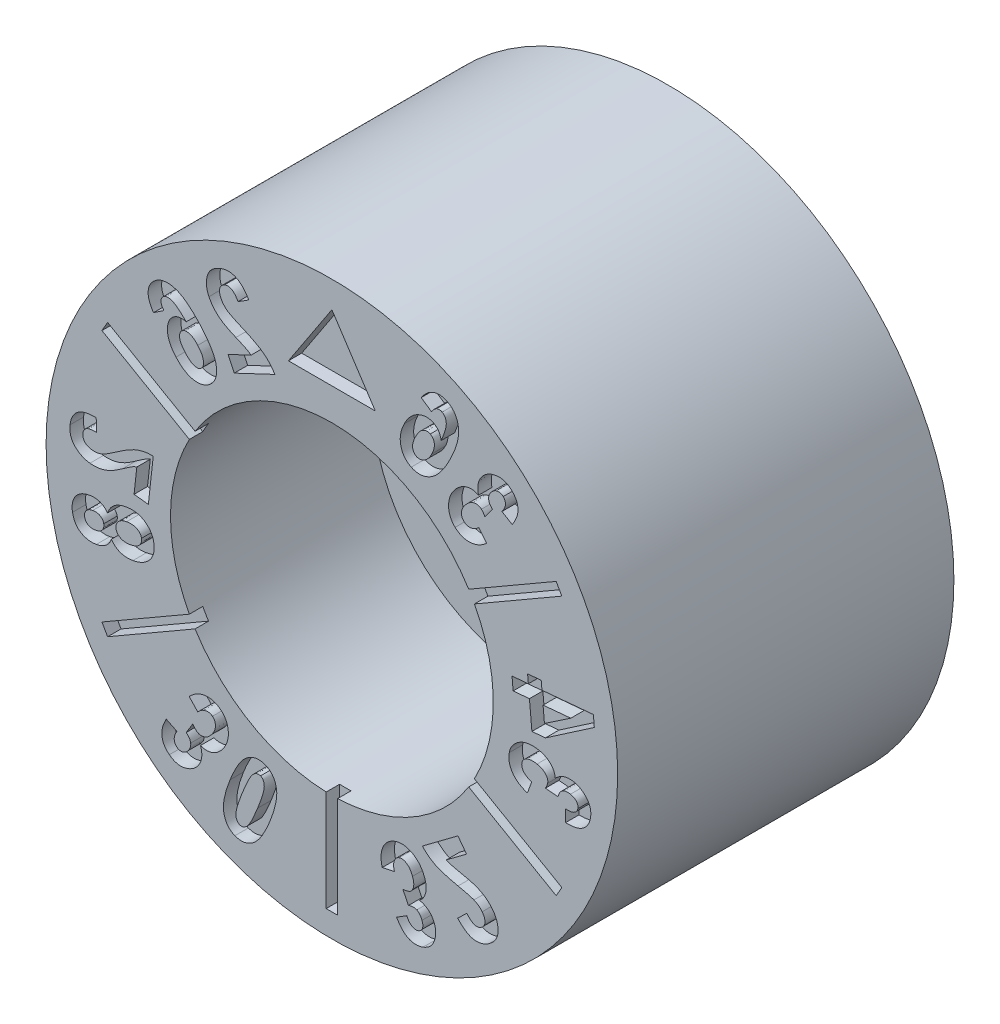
SolidWorks part; units mm, degrees
ref_plane "Front Plane" through (0, 0, 0) normal (0, 0, 1) x (1, 0, 0)
ref_plane "Top Plane" through (0, 0, 0) normal (0, 1, 0) x (1, 0, 0)
ref_plane "Right Plane" through (0, 0, 0) normal (1, 0, 0) x (0, 0, -1)
imported_body "Imported1"
other "Move Face1" parameters "D1"=0.18
other "DeleteFace1"
sketch "Sketch1" plane through (0, 0, 0) normal (0, 0, 1) x (1, 0, 0)
  line L0 (0, 0) -> (0, -4.8695) construction
  line L1 (0, 0) -> (-2.4347, -4.2171) construction
  line L2 (-0.085, -2.3069) -> (0.085, -2.3069)
  line L3 (-0.085, -2.3069) -> (-0.085, -3.9)
  line L4 (-0.085, -3.9) -> (0.085, -3.9)
  line L5 (0.085, -2.3069) -> (0.085, -3.9)
  line L10 (0, 0) -> (-4.2171, -2.4347) construction
  line L11 (-1.9553, -1.2271) -> (-3.335, -2.0236)
  line L12 (-2.0403, -1.0798) -> (-3.42, -1.8764)
  line L13 (-3.42, -1.8764) -> (-3.335, -2.0236)
  line L14 (-2.0403, -1.0798) -> (-1.9553, -1.2271)
  line L15 (0, 0) -> (-4.8695, 0) construction
  line L20 (0, 0) -> (-4.2171, 2.4347) construction
  line L21 (-2.0403, 1.0798) -> (-3.42, 1.8764)
  line L22 (-1.9553, 1.2271) -> (-3.335, 2.0236)
  line L23 (-3.335, 2.0236) -> (-3.42, 1.8764)
  line L24 (-1.9553, 1.2271) -> (-2.0403, 1.0798)
  line L25 (0, 0) -> (-2.4347, 4.2171) construction
  line L30 (0, 0) -> (0, 4.8695) construction
  line L35 (0, 0) -> (2.4347, 4.2171) construction
  line L40 (0, 0) -> (4.2171, 2.4347) construction
  line L41 (1.9553, 1.2271) -> (3.335, 2.0236)
  line L42 (2.0403, 1.0798) -> (3.42, 1.8764)
  line L43 (3.42, 1.8764) -> (3.335, 2.0236)
  line L44 (2.0403, 1.0798) -> (1.9553, 1.2271)
  line L45 (0, 0) -> (4.8695, 0) construction
  line L50 (0, 0) -> (4.2171, -2.4347) construction
  line L51 (2.0403, -1.0798) -> (3.42, -1.8764)
  line L52 (1.9553, -1.2271) -> (3.335, -2.0236)
  line L53 (3.335, -2.0236) -> (3.42, -1.8764)
  line L54 (1.9553, -1.2271) -> (2.0403, -1.0798)
  line L55 (0, 0) -> (2.4347, -4.2171) construction
  line L101 (0.085, 3.9) -> (-0.085, 3.9)
  line L102 (0.085, 2.3069) -> (0.085, 3.9)
  line L103 (-0.085, 2.3069) -> (-0.085, 3.9)
  line L104 (0.085, 2.3069) -> (-0.085, 2.3069)
  line L105 (1.0798, 2.0403) -> (1.8764, 3.42)
  line L106 (1.2271, 1.9553) -> (2.0236, 3.335)
  line L107 (2.0236, 3.335) -> (1.8764, 3.42)
  line L108 (1.2271, 1.9553) -> (1.0798, 2.0403)
  line L109 (-1.0798, 2.0403) -> (-1.2271, 1.9553)
  line L110 (-1.0798, 2.0403) -> (-1.8764, 3.42)
  line L111 (-1.2271, 1.9553) -> (-2.0236, 3.335)
  line L112 (-1.8764, 3.42) -> (-2.0236, 3.335)
  line L113 (-2.3069, 0.085) -> (-3.9, 0.085)
  line L114 (-2.3069, -0.085) -> (-3.9, -0.085)
  line L115 (-3.9, 0.085) -> (-3.9, -0.085)
  line L116 (-2.3069, 0.085) -> (-2.3069, -0.085)
  line L117 (2.3069, 0.085) -> (3.9, 0.085)
  line L118 (2.3069, -0.085) -> (3.9, -0.085)
  line L119 (3.9, -0.085) -> (3.9, 0.085)
  line L120 (2.3069, -0.085) -> (2.3069, 0.085)
  line L121 (-1.0798, -2.0403) -> (-1.8764, -3.42)
  line L122 (-1.2271, -1.9553) -> (-2.0236, -3.335)
  line L123 (-1.2271, -1.9553) -> (-1.0798, -2.0403)
  line L124 (-2.0236, -3.335) -> (-1.8764, -3.42)
  line L125 (1.2271, -1.9553) -> (2.0236, -3.335)
  line L126 (1.0798, -2.0403) -> (1.8764, -3.42)
  line L127 (1.0798, -2.0403) -> (1.2271, -1.9553)
  line L128 (1.8764, -3.42) -> (2.0236, -3.335)
  arc A1 (-0.8173, 2.6127) -> (0, 2.7376) centre (0, 0) ccw construction
  text T0 "26   28   30   32   34   36" font "Arial Narrow" height 1.2
  point P10 (0, 0)
  point P21 (0, 0)
  point P69 (0, 0)
  dimension "D5" = 12
  dimension "D1" = 2.7376
extrude "Cut-Extrude1" cut sketch "Sketch1" against normal blind 0.2
